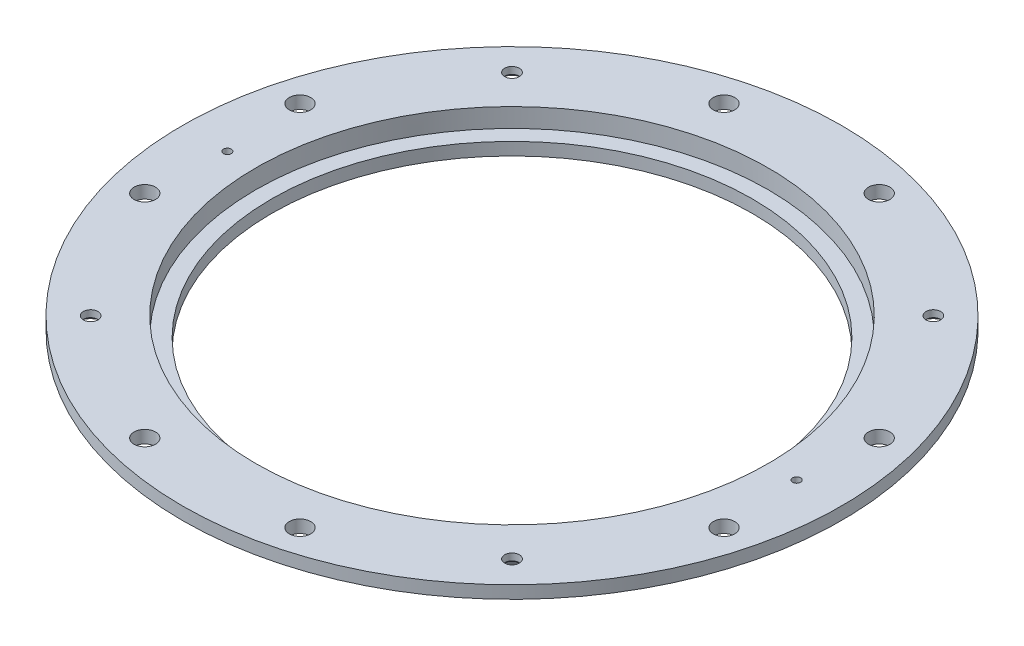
SolidWorks part; units mm, degrees
ref_plane "Front Plane" through (0, 0, 0) normal (0, 0, 1) x (1, 0, 0)
ref_plane "Top Plane" through (0, 0, 0) normal (0, 1, 0) x (1, 0, 0)
ref_plane "Right Plane" through (0, 0, 0) normal (1, 0, 0) x (0, 0, -1)
sketch "Sketch1" plane through (0, 0, 0) normal (0, 1, 0) x (1, 0, 0)
  circle A0 centre (0, 0) radius 66.167
  dimension "D1" = 132.334
extrude "Boss-Extrude1" add sketch "Sketch1" along normal blind 2.54
sketch "Sketch2" plane through (0, 0, 0) normal (0, -1, 0) x (1, 0, 0)
  circle A0 centre (0, 0) radius 52.07
  dimension "D1" = 104.14
extrude "Boss-Extrude2" add sketch "Sketch2" along normal blind 3.81
sketch "Sketch6" plane through (0, 2.54, 0) normal (0, 1, 0) x (1, 0, 0)
  circle A0 centre (0, 0) radius 42.418
  dimension "D1" = 84.836
extrude "Cut-Extrude3" cut sketch "Sketch6" against normal through all
sketch "Sketch7" plane through (0, 2.54, 0) normal (0, 1, 0) x (1, 0, 0)
  circle A0 centre (0, 0) radius 45.72
  dimension "D1" = 91.44
extrude "Cut-Extrude4" cut sketch "Sketch7" against normal offset from surface (3.81 mm away) 2.54
sketch "Sketch8" plane through (0, 2.54, 0) normal (0, 1, 0) x (1, 0, 0)
  line L0 (-66.167, 0) -> (66.167, 0) construction
  line L1 (0, -66.167) -> (0, 66.167) construction
  circle A0 centre (0, 0) radius 66.167 construction
hole_wizard "1/16 (0.0625) Clearance Dowel Hole1" positions "Sketch9" profile "Sketch10" hole size "1/16" standard "ANSI Inch"
sketch "Sketch9" plane through (0, 2.54, 0) normal (0, 1, 0) x (1, 0, 0)
  line L0 (-66.167, 0) -> (66.167, 0) construction
  circle A0 centre (0, 0) radius 66.167 construction
  point P0 (57.15, 0)
  point P4 (-57.15, 0)
  dimension "D1" = 57.15
  dimension "D2" = 57.15
sketch "Sketch10" plane through (57.15, 2.54, 0) normal (1, 0, 0) x (0, 0, 1)
  line L0 (0, 0) -> (0, 6.35)
  line L1 (0, 6.35) -> (0.7937, 6.35)
  line L2 (0.7937, 6.35) -> (0.7937, 0)
  line L5 (0.7937, 0) -> (0, 0)
  line L11 (0, -6.35) -> (0, 107.95) construction
  dimension "Thru Hole Dia." = 1.5875
  dimension "Thru Hole Depth" = 6.35
hole_wizard "CSK for #4 Flat Head Machine Screw (100)1" positions "Sketch11" profile "Sketch12" countersink size "#4" standard "ANSI Inch"
sketch "Sketch11" plane through (0, 0, 0) normal (0, -1, 0) x (-1, 0, 0)
  line L0 (0, 0) -> (46.7871, -46.7871) construction
  line L1 (46.7871, -46.7871) -> (-46.7871, 46.7871) construction
  line L3 (0, 0) -> (-46.7871, -46.7871) construction
  line L4 (-46.7871, -46.7871) -> (46.7871, 46.7871) construction
  circle A0 centre (0, 0) radius 66.167 construction
  point P17 (42.297, -42.297)
  point P19 (-42.297, -42.297)
  point P21 (-42.297, 42.297)
  point P23 (42.297, 42.297)
  dimension "D1" = 6.35
  dimension "D2" = 6.35
  dimension "D3" = 6.35
  dimension "D4" = 6.35
sketch "Sketch12" plane through (-42.297, 0, -42.297) normal (1, 0, 0) x (0, 0, -1)
  line L0 (0, 0) -> (0, 2.54)
  line L1 (0, 2.54) -> (1.4732, 2.54)
  line L2 (1.4732, 2.54) -> (1.4732, 1.1616)
  line L3 (1.4732, 1.1616) -> (2.8575, 0)
  line L5 (2.8575, 0) -> (0, 0)
  line L6 (-1.4732, 1.1616) -> (-2.8575, 0) construction
  line L11 (0, -6.35) -> (0, 107.95) construction
  dimension "Thru Hole Dia." = 2.9464
  dimension "Thru Hole Depth" = 2.54
  dimension "Near C'Sink Dia." = 5.715
  dimension "Near C'Sink Angle" = 100
hole_wizard "#18 (0.1695) Diameter Hole1" positions "Sketch13" profile "Sketch14" hole size "#18" standard "ANSI Inch"
sketch "Sketch13" plane through (0, 2.54, 0) normal (0, 1, 0) x (1, 0, 0)
  point P0 (-58.1468, -15.5804)
  point P3 (-58.1468, 15.5804)
  point P6 (-15.5804, 58.1468)
  point P9 (15.5804, 58.1468)
  point P12 (58.1468, 15.5804)
  point P15 (58.1468, -15.5804)
  point P19 (15.5804, -58.1468)
  point P22 (-15.5804, -58.1468)
sketch "Sketch14" plane through (-58.1468, 2.54, 15.5804) normal (1, 0, 0) x (0, 0, 1)
  line L0 (0, 0) -> (0, 6.35)
  line L1 (0, 6.35) -> (2.1526, 6.35)
  line L2 (2.1526, 6.35) -> (2.1526, 0)
  line L5 (2.1526, 0) -> (0, 0)
  line L11 (0, -6.35) -> (0, 107.95) construction
  dimension "Thru Hole Dia." = 4.3053
  dimension "Thru Hole Depth" = 6.35
sketch "Sketch15" plane through (0, 2.54, 0) normal (0, 1, 0) x (1, 0, 0)
  line L0 (-66.167, 0) -> (66.167, 0) construction
  circle A0 centre (0, 0) radius 51.435
  dimension "D1" = 102.87
extrude "Cut-Extrude5" cut sketch "Sketch15" against normal up to surface (3.81 mm away)
sketch "Sketch16" plane through (0, -1.27, 0) normal (0, 1, 0) x (1, 0, 0)
  line L0 (0, -66.167) -> (0, 66.167) construction
  circle A0 centre (0, 0) radius 48.26
  dimension "D1" = 96.52
extrude "Cut-Extrude6" cut sketch "Sketch16" against normal through all
